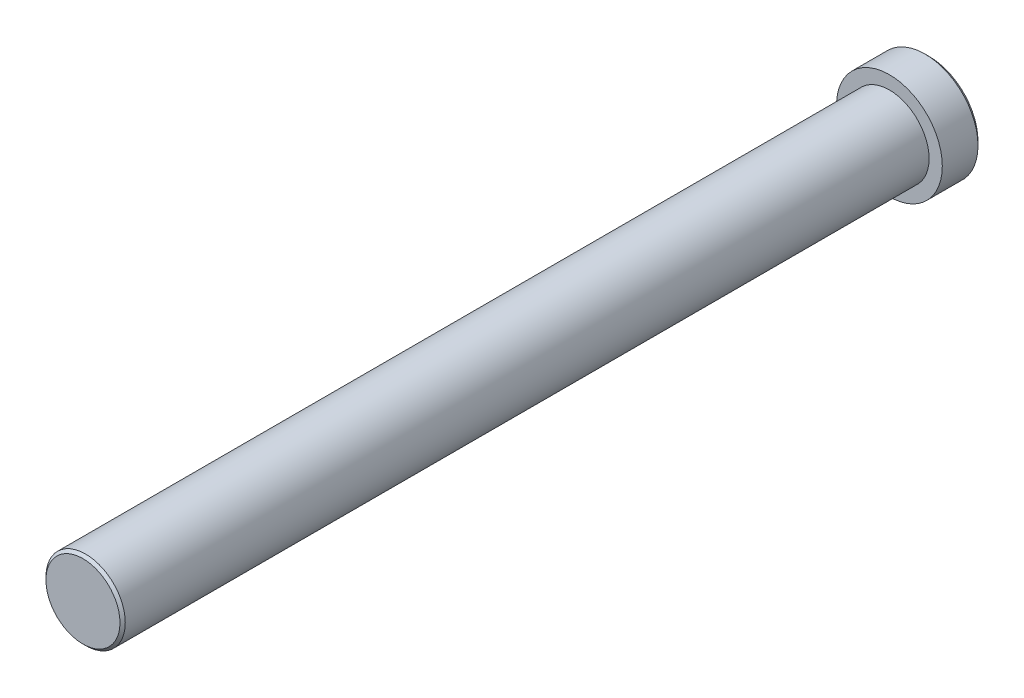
SolidWorks part; units mm, degrees
ref_plane "前视基准面" through (0, 0, 0) normal (0, 0, 1) x (1, 0, 0)
ref_plane "上视基准面" through (0, 0, 0) normal (0, 1, 0) x (1, 0, 0)
ref_plane "右视基准面" through (0, 0, 0) normal (1, 0, 0) x (0, 0, -1)
sketch "草图1" plane through (0, 0, 0) normal (0, 0, 1) x (1, 0, 0)
  circle A0 centre (0, 0) radius 2
  dimension "D1" = 4
extrude "凸台-拉伸1" add sketch "草图1" along normal blind 33
sketch "草图2" plane through (0, 0, 33) normal (0, 0, 1) x (1, 0, 0)
  circle A0 centre (0, 0) radius 1.5
  dimension "D1" = 3
extrude "切除-拉伸1" cut sketch "草图2" against normal blind 31.5 flip side to cut
sketch "草图3" plane through (0, 0, 0) normal (0, 0, -1) x (-1, 0, 0)
  line L0 (-0.5, 0.5) -> (-1.5, 0.5)
  line L1 (1.5, 0.5) -> (0.5, 0.5)
  line L2 (1.5, 0.5) -> (1.5, -0.5)
  line L3 (1.5, -0.5) -> (0.5, -0.5)
  line L4 (-1.5, 0.5) -> (-1.5, -0.5)
  line L5 (-1.5, 0) -> (1.5, 0) construction
  line L6 (0.5, -0.5) -> (-0.5, -0.5) construction
  line L7 (0.5, -1.5) -> (-0.5, -1.5)
  line L8 (0.5, -1.5) -> (0.5, -0.5)
  line L9 (0.5, 1.5) -> (-0.5, 1.5)
  line L10 (-0.5, -1.5) -> (-0.5, -0.5)
  line L11 (0.5, -0.5) -> (0.5, 0.5) construction
  line L12 (0.5, 0.5) -> (-0.5, 0.5) construction
  line L13 (-0.5, 0.5) -> (-0.5, 1.5)
  line L14 (-0.5, -0.5) -> (-0.5, 0.5) construction
  line L15 (-0.5, -0.5) -> (-1.5, -0.5)
  line L16 (0.5, -0.5) -> (-0.5, 0.5) construction
  line L17 (0.5, 0.5) -> (-0.5, -0.5) construction
  line L18 (0.5, 0.5) -> (0.5, 1.5)
  line L19 (0, 1.5) -> (0, -1.5) construction
  point P0 (0, 0)
  point P6 (0, 0)
  point P11 (0, 0)
  dimension "D1" = 1
  dimension "D2" = 3
  dimension "D3" = 1
  dimension "D4" = 3
extrude "切除-拉伸2" cut sketch "草图3" against normal blind 1
chamfer "倒角1" distance 0.15 angle 45 1 edges at (2, 0, 0)
chamfer "倒角2" distance 0.1 angle 45 1 edges at (1.5, 0, 33)
sketch "草图4" plane through (0, 0, 33) normal (0, 0, 1) x (1, 0, 0)
  circle A0 centre (0, 0) radius 1.5
  dimension "D1" = 3
extrude "切除-拉伸3" cut sketch "草图4" against normal blind 1
chamfer "倒角3" distance 0.1 angle 45 1 edges at (1.5, 0, 32)
